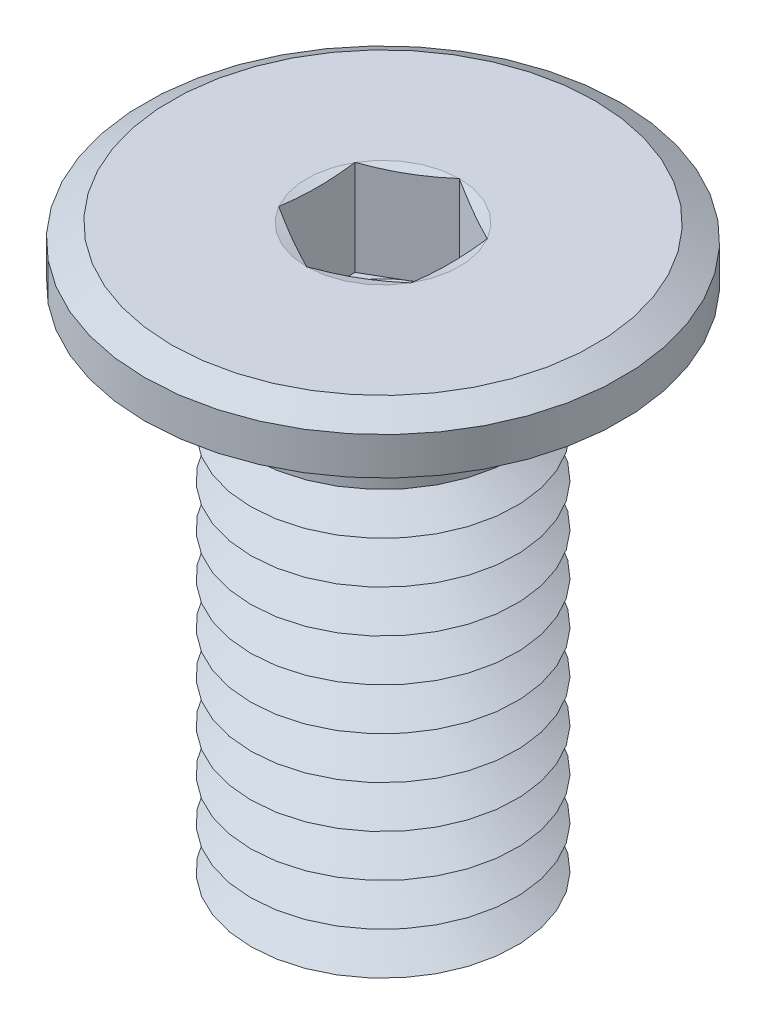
SolidWorks part; units mm, degrees
ref_plane "Front Plane" through (0, 0, 0) normal (0, 0, 1) x (1, 0, 0)
ref_plane "Top Plane" through (0, 0, 0) normal (0, 1, 0) x (1, 0, 0)
ref_plane "Right Plane" through (0, 0, 0) normal (1, 0, 0) x (0, 0, -1)
sketch "Sketch1" plane through (0, 0, 0) normal (0, 1, 0) x (1, 0, 0)
  circle A0 centre (0, 0) radius 4.5
  dimension "D1" = 9
extrude "Boss-Extrude1" add sketch "Sketch1" against normal blind 1
sketch "Sketch2" plane through (0, -1, 0) normal (0, -1, 0) x (1, 0, 0)
  circle A0 centre (0, 0) radius 2.5
  dimension "D1" = 5
extrude "Boss-Extrude2" add sketch "Sketch2" along normal blind 10
sketch "Sketch3" plane through (0, 0, 0) normal (1, 0, 0) x (0, 0, -1)
  line L0 (0, 0.9906) -> (0, -8.2999) construction
sketch "Sketch5" plane through (0, 0, 0) normal (1, 0, 0) x (0, 0, -1)
  line L0 (-2.5, -11.4) -> (-1.8072, -11)
  line L1 (-2.5, -1) -> (-2.5, -11) construction
  line L2 (-1.8072, -11) -> (-2.5, -10.6)
  line L3 (-2.5, -1) -> (-2.5, -11) construction
  line L4 (-2.5, -10.6) -> (-2.5, -11.4)
  line L6 (-2.5, -1) -> (-2.5, -11) construction
  line L7 (-2.5, -1) -> (-2.5, -11) construction
  line L14 (-2.5, -11) -> (2.5, -11) construction
  dimension "D1" = 0.8
revolve "Cut-Revolve1" cut sketch "Sketch5" angle 360 about L0
pattern_linear "LPattern1" count 11 spacing 0.8 along (0, 1, 0) of "Cut-Revolve1"
fillet "Fillet1" radius 0.2 1 edges at (0, -1, -2.5)
chamfer "Chamfer2" distance 0.5 angle 30 1 edges at (0, 0, 4.5)
sketch "Sketch6" plane through (0, 0, 0) normal (0, 1, 0) x (1, 0, 0)
  line L1 (0, 1.4434) -> (-1.25, 0.7217)
  line L2 (-1.25, 0.7217) -> (-1.25, -0.7217)
  line L3 (-1.25, -0.7217) -> (0, -1.4434)
  line L4 (0, -1.4434) -> (1.25, -0.7217)
  line L5 (1.25, -0.7217) -> (1.25, 0.7217)
  line L6 (1.25, 0.7217) -> (0, 1.4434)
  circle A0 centre (0, 0) radius 1.25 construction
  dimension "D1" = 2.5
extrude "Cut-Extrude1" cut sketch "Sketch6" against normal blind 1.8
sketch "Sketch7" plane through (0, -1.8, 0) normal (0, 1, 0) x (1, 0, 0)
  line L0 (-1.25, 0.7217) -> (-1.25, -0.7217) construction
  circle A0 centre (0, 0) radius 1.25
extrude "Cut-Extrude2" cut sketch "Sketch7" against normal through all draft 60
sketch "Sketch8" plane through (0, 0, 0) normal (0, 1, 0) x (1, 0, 0)
  circle A0 centre (0, 0) radius 1.4434
extrude "Cut-Extrude3" cut sketch "Sketch8" against normal through all draft 75
